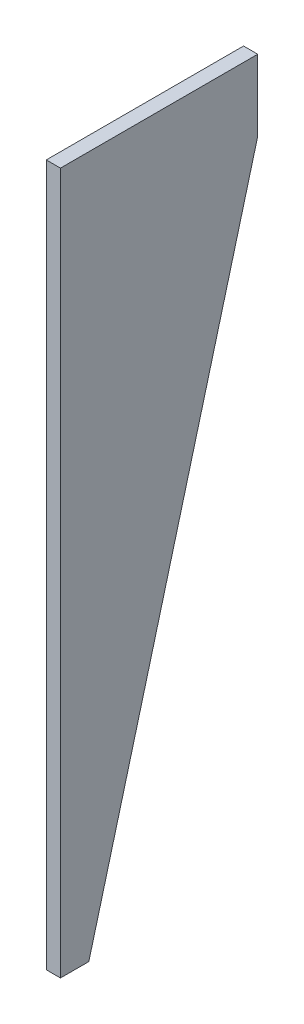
SolidWorks part; units mm, degrees
ref_plane "Front Plane" through (0, 0, 0) normal (0, 0, 1) x (1, 0, 0)
ref_plane "Top Plane" through (0, 0, 0) normal (0, 1, 0) x (1, 0, 0)
ref_plane "Right Plane" through (0, 0, 0) normal (1, 0, 0) x (0, 0, -1)
sketch "Sketch1" plane through (0, 0, 0) normal (0, 0, 1) x (1, 0, 0)
  line L1 (283.2242, -354.5041) -> (283.2242, 89.8218) construction
  line L2 (283.2242, -353.21) -> (283.2242, 91.1159)
  line L3 (273.2242, -353.21) -> (273.2242, 91.1159)
  line L6 (273.2242, -354.5041) -> (273.2242, 89.8218) construction
  line L7 (283.2242, -354.5041) -> (283.2242, 89.8218) construction
  line L8 (283.2242, 91.1159) -> (-176.7758, 91.1159) construction
  line L9 (283.2242, 91.1159) -> (273.2242, 91.1159)
  line L10 (-176.7758, -353.21) -> (283.2242, -353.21) construction
  line L11 (273.2242, -353.21) -> (283.2242, -353.21)
  point P11 (0, 0)
  dimension "D1" = 10
extrude "Boss-Extrude1" add sketch "Sketch1" against normal up to surface (35.9952 mm away) contours L3 L9 L2 L11
sketch "Sketch3" plane through (283.2242, 0, 0) normal (1, 0, 0) x (0, 0, -1)
  line L1 (0, -353.21) -> (0, 91.1159) construction
  line L2 (0, 327.25) -> (0, -327.25) construction
  line L3 (0, 91.1159) -> (0, 141.1159)
  line L5 (0, 91.1159) -> (139.0568, 91.1159)
  line L6 (139.0568, 91.1159) -> (139.0568, 141.1159)
  line L7 (139.0568, 141.1159) -> (0, 141.1159)
  dimension "D1" = 50
extrude "Boss-Extrude2" add sketch "Sketch3" against normal up to surface (10 mm away)
